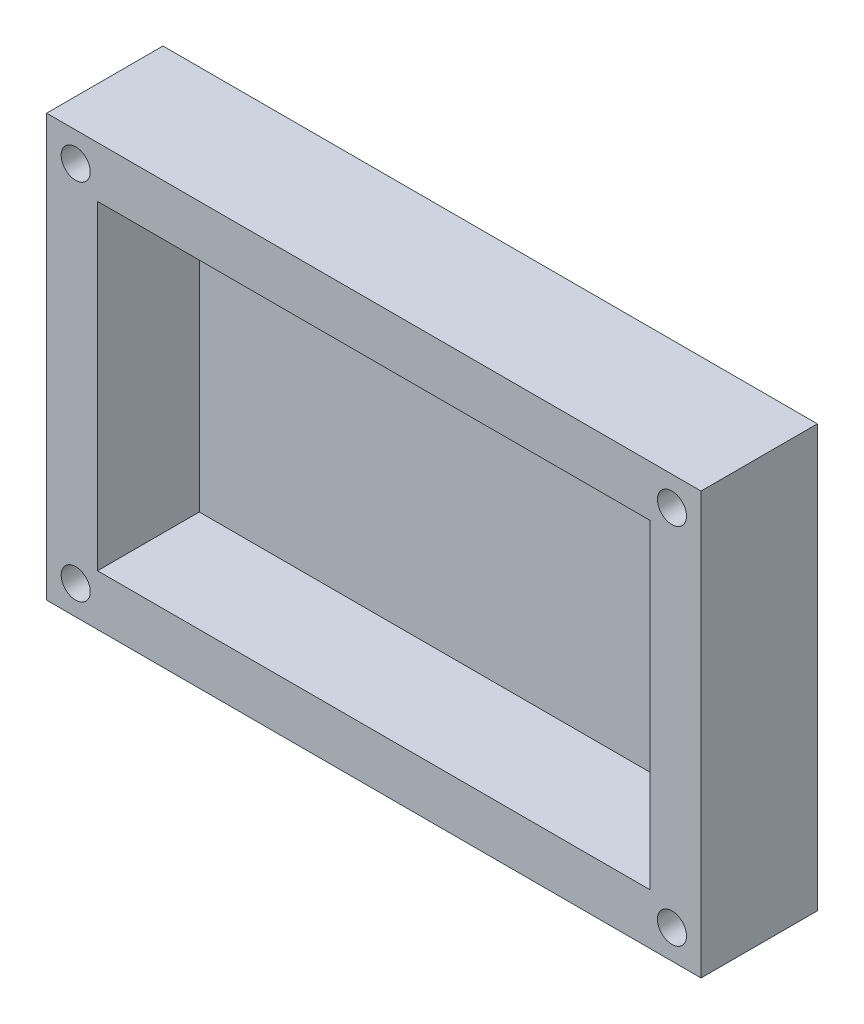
SolidWorks part; units mm, degrees
ref_plane "Alzado" through (0, 0, 0) normal (0, 0, 1) x (1, 0, 0)
ref_plane "Planta" through (0, 0, 0) normal (0, 1, 0) x (1, 0, 0)
ref_plane "Vista lateral" through (0, 0, 0) normal (1, 0, 0) x (0, 0, -1)
sketch "Sketch1" plane through (0, 0, 0) normal (0, 0, 1) x (1, 0, 0)
  line L1 (-22.5, -14.5) -> (22.5, -14.5)
  line L2 (-22.5, -14.5) -> (-22.5, 14.5)
  line L3 (-22.5, 14.5) -> (22.5, 14.5)
  line L4 (22.5, -14.5) -> (22.5, 14.5)
  line L5 (-22.5, -14.5) -> (22.5, 14.5) construction
  line L6 (-22.5, 14.5) -> (22.5, -14.5) construction
  point P0 (0, 0)
  dimension "D1" = 29
  dimension "D2" = 45
extrude "Boss-Extrude1" add sketch "Sketch1" along normal blind 8
sketch "Sketch2" plane through (0, 0, 8) normal (0, 0, 1) x (1, 0, 0)
  line L1 (-19, -11) -> (19, -11)
  line L2 (-19, -11) -> (-19, 11)
  line L3 (-19, 11) -> (19, 11)
  line L4 (19, -11) -> (19, 11)
  line L5 (-19, -11) -> (19, 11) construction
  line L6 (-19, 11) -> (19, -11) construction
  point P0 (0, 0)
  dimension "D1" = 38
  dimension "D2" = 22
extrude "Cut-Extrude1" cut sketch "Sketch2" against normal blind 7
sketch "Sketch3" plane through (0, 0, 8) normal (0, 0, 1) x (1, 0, 0)
  line L0 (-22.5, 14.5) -> (-22.5, -14.5) construction
  line L1 (22.5, 14.5) -> (-22.5, 14.5) construction
  line L2 (22.5, -14.5) -> (22.5, 14.5) construction
  line L3 (-22.5, -14.5) -> (22.5, -14.5) construction
  circle A0 centre (-20.5, 12.5) radius 1
  circle A1 centre (-20.5, -12.5) radius 1
  circle A2 centre (20.5, 12.5) radius 1
  circle A3 centre (20.5, -12.5) radius 1
  dimension "D1" = 2
  dimension "D2" = 2
  dimension "D3" = 2
  dimension "D4" = 2
  dimension "D5" = 2
  dimension "D6" = 2
  dimension "D7" = 2
  dimension "D8" = 2
  dimension "D9" = 2
  dimension "D10" = 2
  dimension "D11" = 2
  dimension "D12" = 2
extrude "Cut-Extrude2" cut sketch "Sketch3" against normal blind 7
